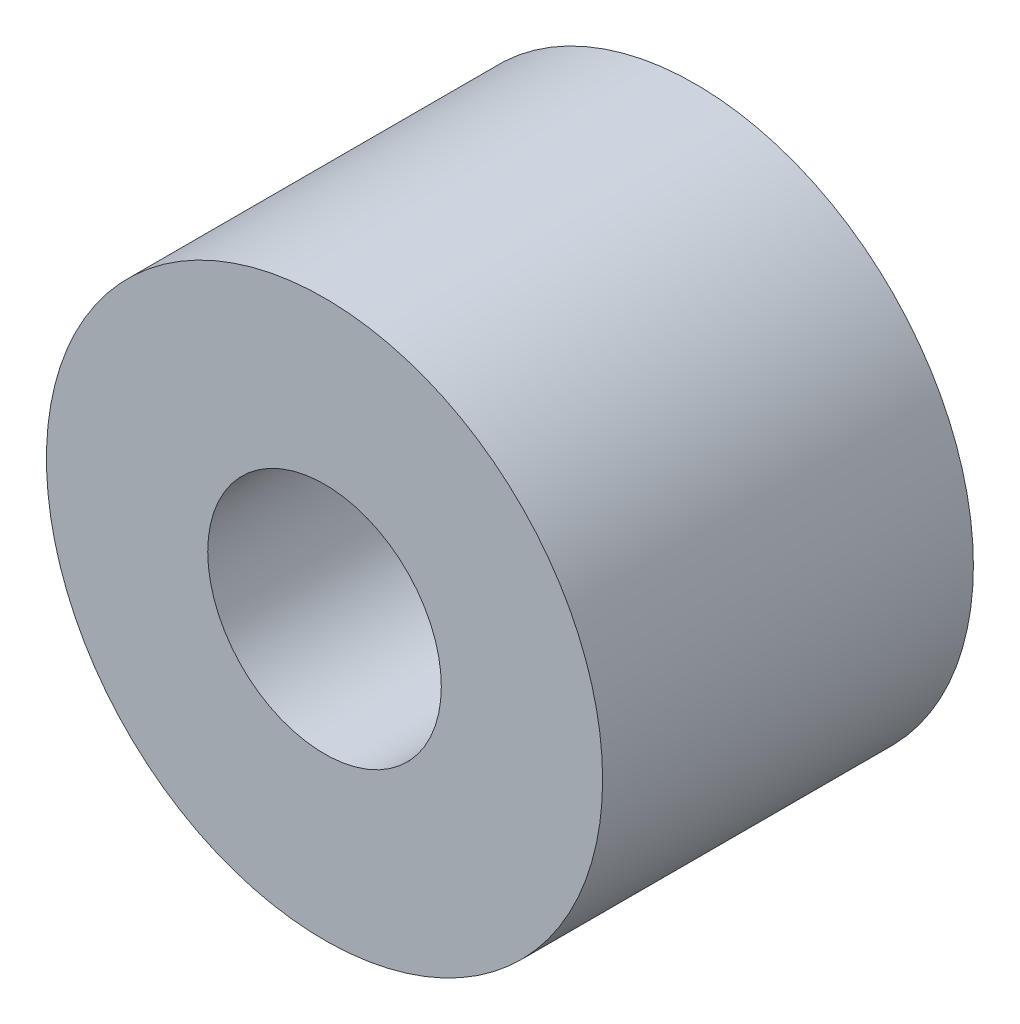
SolidWorks part; units mm, degrees
ref_plane "Front Plane" through (0, 0, 0) normal (0, 0, 1) x (1, 0, 0)
ref_plane "Top Plane" through (0, 0, 0) normal (0, 1, 0) x (1, 0, 0)
ref_plane "Right Plane" through (0, 0, 0) normal (1, 0, 0) x (0, 0, -1)
sketch "Sketch1" plane through (0, 0, 0) normal (0, 0, 1) x (1, 0, 0)
  circle A0 centre (0, 0) radius 4.0005
  circle A1 centre (0, 0) radius 9.525
  dimension "D1" = 8.001
  dimension "D2" = 19.05
extrude "Boss-Extrude1" add sketch "Sketch1" along normal blind 12.7
